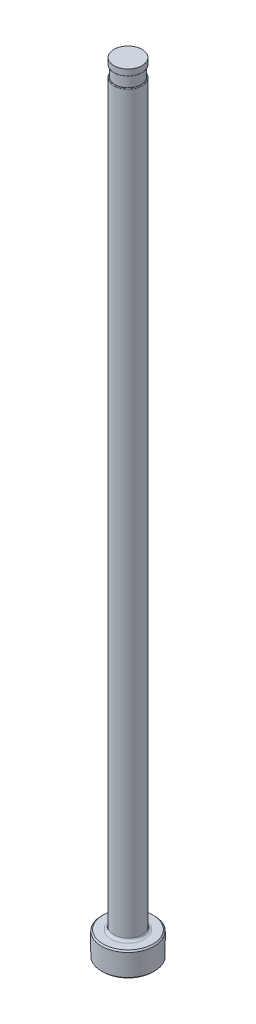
SolidWorks part; units mm, degrees
ref_plane "Front Plane" through (0, 0, 0) normal (0, 0, 1) x (1, 0, 0)
ref_plane "Top Plane" through (0, 0, 0) normal (0, 1, 0) x (1, 0, 0)
ref_plane "Right Plane" through (0, 0, 0) normal (1, 0, 0) x (0, 0, -1)
other "Configuration Table"
sketch "Sketch1" plane through (0, 0, 0) normal (0, 0, 1) x (1, 0, 0)
  line L0 (0, 259.9588) -> (0, -15.1925) construction
  line L1 (0, 0) -> (-5.1562, 0)
  line L2 (-5.1562, 0) -> (-5.1562, 4.7498)
  line L3 (-5.1562, 4.7498) -> (-2.7775, 4.7498)
  line L4 (-2.7775, 4.7498) -> (-2.7775, 152.4)
  line L5 (-2.7775, 152.4) -> (0, 152.4)
  line L6 (0, 152.4) -> (0, 0)
  dimension "L" = 152.4
  dimension "H" = 10.3124
  dimension "T" = 4.7498
  dimension "D" = 5.555
revolve "Revolve1" add sketch "Sketch1" angle 360 about L0
chamfer "Chamfer1" distance 0.254 angle 45 2 edges at (0, 4.7498, 5.1562) (0, 0, 5.1562)
fillet "Fillet1" radius 0.508 1 edges at (0, 4.7498, 2.7775)
sketch "Sketch2" plane through (0, 0, 0) normal (0, 0, 1) x (1, 0, 0)
  line L0 (-2.7775, 152.4) -> (-2.7775, 5.2578) construction
  line L1 (-2.7775, 151.13) -> (-2.5743, 151.13)
  line L2 (-2.7775, 151.13) -> (-2.7775, 149.098)
  line L3 (-2.7775, 149.098) -> (-2.5743, 149.098)
  line L4 (-2.5743, 151.13) -> (-2.5743, 149.098)
  line L5 (2.7775, 152.4) -> (-2.7775, 152.4) construction
  line L6 (0, 153.4483) -> (0, 147.3282) construction
  dimension "D1" = 2.032
  dimension "N" = 1.27
  dimension "FD" = 0.2032
  dimension "D3" = 5.1486
revolve "Vent Relief" cut sketch "Sketch2" angle 360 about L6
sketch "Sketch3" plane through (0, 0, 0) normal (0, 0, 1) x (1, 0, 0)
  line L0 (-2.5743, 150.114) -> (-2.5743, 86.614)
  line L1 (-2.5743, 151.13) -> (-2.5743, 149.098) construction
  line L2 (-2.7775, 149.098) -> (-2.7775, 5.2578) construction
  line L3 (-2.7775, 85.4964) -> (-2.7775, 150.114)
  line L4 (-2.7775, 150.114) -> (-2.5743, 150.114)
  arc A0 (-2.5743, 86.614) -> (-2.7775, 85.4964) centre (-5.7493, 86.614) cw
  dimension "D1" = 3.175
  dimension "D2" = 63.5
extrude "D-Slot" cut sketch "Sketch3" against normal through all both and the other way through all
sketch "Sketch5" plane through (0, 0, 0) normal (0, 0, 1) x (1, 0, 0)
  line L0 (-2.7775, 151.13) -> (2.7775, 151.13) construction
  line L1 (-2.7775, 152.4) -> (-2.7584, 152.4)
  line L2 (-2.7775, 152.4) -> (-2.7775, 151.13)
  line L3 (-2.7775, 151.13) -> (-2.7584, 151.13)
  line L4 (-2.7584, 152.4) -> (-2.7584, 151.13)
  line L5 (0, 152.6877) -> (0, 150.5771) construction
  dimension "VP" = 0.019
revolve "Vent Diameter" cut sketch "Sketch5" angle 360 about L5
fillet "Fillet2" radius 0.127 2 edges at (2.7775, 149.098, 0) (0, 151.13, 2.7584)
sketch "Pocket Sketch" plane through (0, 0, 0) normal (0, 0, 1) x (1, 0, 0)
  line L0 (-5.5531, 0) -> (-5.5531, 4.7752)
  line L1 (-5.5531, 4.7752) -> (-3.7379, 4.7752)
  line L2 (-2.9759, 5.5372) -> (-2.9759, 22.225)
  line L3 (-2.9759, 22.225) -> (0, 22.225)
  line L4 (0, 22.225) -> (0, 0)
  line L5 (0, 0) -> (-5.5531, 0)
  line L6 (0, 12.6104) -> (0, -2.4989) construction
  line L7 (-5.1562, 4.4958) -> (-5.1562, 0.254) construction
  line L8 (4.9022, 4.7498) -> (-4.9022, 4.7498) construction
  line L9 (-2.7775, 85.4964) -> (-2.7775, 5.2578) construction
  line L10 (-3.7379, 4.7752) -> (-2.9759, 5.5372)
  point P3 (-2.9759, 4.7752)
  dimension "D1" = 11.1061
  dimension "D2" = 0.3969
  dimension "D3" = 0.0254
  dimension "D4" = 0.1984
  dimension "D5" = 5.9519
  dimension "D6" = 22.225
